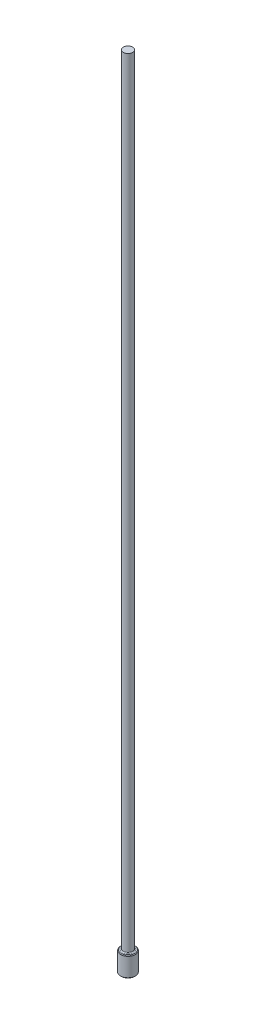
SolidWorks part; units mm, degrees
ref_plane "Front Plane" through (0, 0, 0) normal (0, 0, 1) x (1, 0, 0)
ref_plane "Top Plane" through (0, 0, 0) normal (0, 1, 0) x (1, 0, 0)
ref_plane "Right Plane" through (0, 0, 0) normal (1, 0, 0) x (0, 0, -1)
other "Configuration Table"
sketch "Sketch1" plane through (0, 0, 0) normal (0, 0, 1) x (1, 0, 0)
  line L0 (0, 259.9588) -> (0, -15.1925) construction
  line L1 (0, 0) -> (-0.5842, 0)
  line L2 (-0.5842, 0) -> (-0.5842, 1.5748)
  line L3 (-0.5842, 1.5748) -> (-0.3683, 1.5748)
  line L4 (-0.3683, 1.5748) -> (-0.3683, 63.5)
  line L5 (-0.3683, 63.5) -> (0, 63.5)
  line L6 (0, 63.5) -> (0, 0)
  dimension "L" = 63.5
  dimension "H" = 1.1684
  dimension "T" = 1.5748
  dimension "D" = 0.7366
revolve "Revolve1" add sketch "Sketch1" angle 360 about L0
chamfer "Chamfer1" distance 0.0508 angle 45 2 edges at (0, 1.5748, 0.5842) (0, 0, 0.5842)
fillet "Fillet1" radius 0.0762 1 edges at (0, 1.5748, 0.3683)
